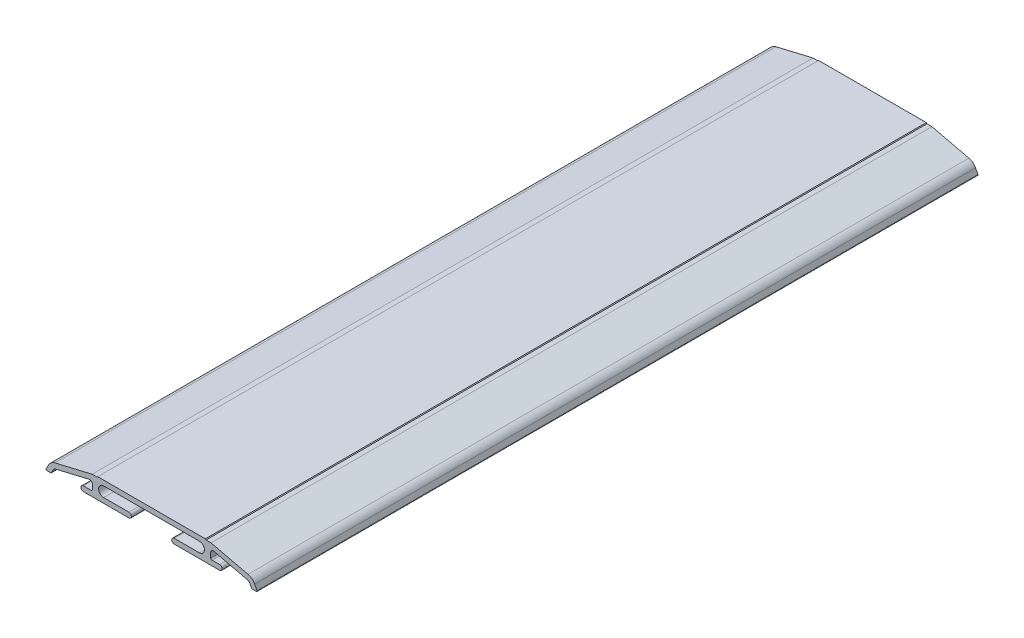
SolidWorks part; units mm, degrees
ref_plane "前视基准面" through (0, 0, 0) normal (0, 0, 1) x (1, 0, 0)
ref_plane "上视基准面" through (0, 0, 0) normal (0, 1, 0) x (1, 0, 0)
ref_plane "右视基准面" through (0, 0, 0) normal (1, 0, 0) x (0, 0, -1)
sketch "草图1" plane through (0, 0, 0) normal (0, 0, 1) x (1, 0, 0)
  line B0 (41.2841, 54.3397) -> (40.3426, 56.1286)
  line B1 (37.7225, 58.1586) -> (23.0284, 61.63)
  line B2 (23.0284, 61.63) -> (21.0655, 61.63)
  line B3 (21.0655, 61.63) -> (20.7955, 61.9)
  line B4 (20.7955, 61.9) -> (-21.9045, 61.9)
  line B5 (-21.9045, 61.9) -> (-22.1745, 61.63)
  line B6 (-22.1745, 61.63) -> (-24.1375, 61.63)
  line B7 (-24.1375, 61.63) -> (-38.8316, 58.1586)
  line B8 (-41.4517, 56.1286) -> (-42.3931, 54.3397)
  line B9 (-42.1277, 53.9) -> (-40.5456, 53.9)
  line B10 (-40.2802, 54.0603) -> (-39.6819, 55.1972)
  line B11 (-38.3718, 56.2122) -> (-25.2545, 59.3111)
  line B12 (-24.0245, 58.3379) -> (-24.0245, 56.4)
  line B13 (-24.5245, 55.9) -> (-27.5545, 55.9)
  line B14 (-27.5545, 53.9) -> (-9.5545, 53.9)
  line B15 (-9.5545, 55.9) -> (-19.5545, 55.9)
  line B16 (-19.5545, 59.9) -> (18.4455, 59.9)
  line B17 (18.4455, 55.9) -> (8.4455, 55.9)
  line B18 (8.4455, 53.9) -> (26.4455, 53.9)
  line B19 (26.4455, 55.9) -> (23.4155, 55.9)
  line B20 (22.9155, 56.4) -> (22.9155, 58.3379)
  line B21 (24.1454, 59.3111) -> (37.2627, 56.2122)
  line B22 (38.5728, 55.1972) -> (39.1711, 54.0603)
  line B23 (39.4365, 53.9) -> (41.0186, 53.9)
  arc B24 (41.0186, 53.9) -> (41.2841, 54.3397) centre (41.0186, 54.2) ccw
  arc B25 (40.3426, 56.1286) -> (37.7225, 58.1586) centre (36.8029, 54.2658) ccw
  arc B26 (-38.8316, 58.1586) -> (-41.4517, 56.1286) centre (-37.912, 54.2658) ccw
  arc B27 (-42.3931, 54.3397) -> (-42.1277, 53.9) centre (-42.1277, 54.2) ccw
  arc B28 (-40.5456, 53.9) -> (-40.2802, 54.0603) centre (-40.5456, 54.2) ccw
  arc B29 (-39.6819, 55.1972) -> (-38.3718, 56.2122) centre (-37.912, 54.2658) cw
  arc B30 (-25.2545, 59.3111) -> (-24.0245, 58.3379) centre (-25.0245, 58.3379) cw
  arc B31 (-24.0245, 56.4) -> (-24.5245, 55.9) centre (-24.5245, 56.4) cw
  arc B32 (-27.5545, 55.9) -> (-27.5545, 53.9) centre (-27.5545, 54.9) ccw
  arc B33 (-9.5545, 53.9) -> (-9.5545, 55.9) centre (-9.5545, 54.9) ccw
  arc B34 (-19.5545, 55.9) -> (-19.5545, 59.9) centre (-19.5545, 57.9) cw
  arc B35 (18.4455, 59.9) -> (18.4455, 55.9) centre (18.4455, 57.9) cw
  arc B36 (8.4455, 55.9) -> (8.4455, 53.9) centre (8.4455, 54.9) ccw
  arc B37 (26.4455, 53.9) -> (26.4455, 55.9) centre (26.4455, 54.9) ccw
  arc B38 (23.4155, 55.9) -> (22.9155, 56.4) centre (23.4155, 56.4) cw
  arc B39 (22.9155, 58.3379) -> (24.1454, 59.3111) centre (23.9155, 58.3379) cw
  arc B40 (37.2627, 56.2122) -> (38.5728, 55.1972) centre (36.8029, 54.2658) cw
  arc B41 (39.1711, 54.0603) -> (39.4365, 53.9) centre (39.4365, 54.2) ccw
sketch_block_instance "块1-1"
sketch_block "块1"
extrude "凸台-拉伸1" add sketch "草图1" against normal blind 286
